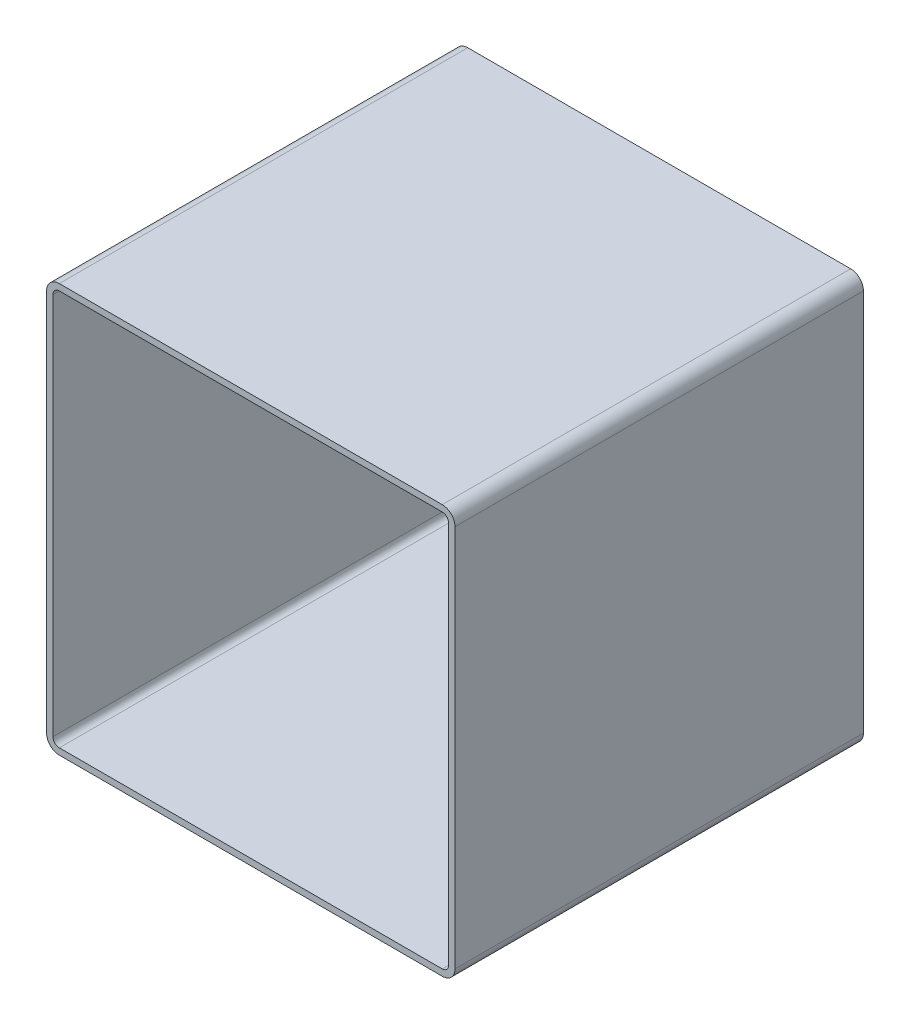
SolidWorks part; units mm, degrees
ref_plane "Front Plane" through (0, 0, 0) normal (0, 0, 1) x (1, 0, 0)
ref_plane "Top Plane" through (0, 0, 0) normal (0, 1, 0) x (1, 0, 0)
ref_plane "Right Plane" through (0, 0, 0) normal (1, 0, 0) x (0, 0, -1)
sketch "Sketch1" plane through (0, 0, 0) normal (0, 0, 1) x (1, 0, 0)
sketch_block_instance "HSS12x12x0.1875-1"
sketch_block "HSS12x12x0.1875"
extrude "Boss-Extrude1" add sketch "Sketch1" along normal blind 304.8
